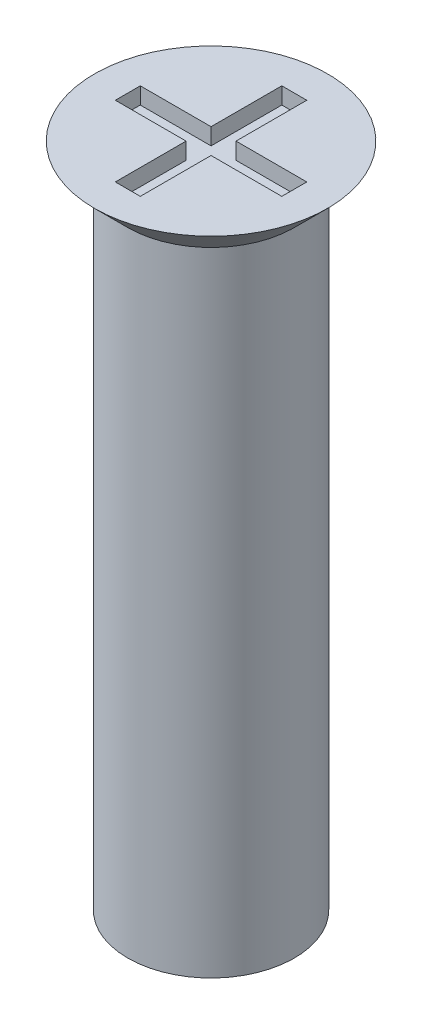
SolidWorks part; units mm, degrees
ref_plane "Front Plane" through (0, 0, 0) normal (0, 0, 1) x (1, 0, 0)
ref_plane "Top Plane" through (0, 0, 0) normal (0, 1, 0) x (1, 0, 0)
ref_plane "Right Plane" through (0, 0, 0) normal (1, 0, 0) x (0, 0, -1)
sketch "Sketch1" plane through (0, 0, 0) normal (0, 0, 1) x (1, 0, 0)
  line L0 (0, 2.4758) -> (0, -1.3504) construction
  line L1 (0, 0) -> (-0.5, 0)
  line L2 (-0.5, 0) -> (-0.5, 3.8)
  line L3 (-0.5, 3.8) -> (-0.7, 4)
  line L4 (-0.7, 4) -> (0, 4)
  line L5 (0, 4) -> (0, 0)
  dimension "D1" = 1
  dimension "D2" = 4
  dimension "D3" = 1.4
  dimension "D4" = 0.2
revolve "Revolve1" add sketch "Sketch1" angle 360 about L0
sketch "Sketch2" plane through (0, 4, 0) normal (0, 1, 0) x (1, 0, 0)
  line L0 (-0.075, 0) -> (0.5, 0) construction
  line L1 (0, 0.075) -> (0, -0.5) construction
  line L2 (-0.075, -0.075) -> (-0.075, -0.5)
  line L3 (-0.075, 0.5) -> (0.075, 0.5)
  line L4 (-0.075, 0.5) -> (-0.075, 0.075)
  line L5 (-0.075, -0.5) -> (0.075, -0.5)
  line L6 (0.075, 0.5) -> (0.075, 0.075)
  line L7 (0.5, 0.075) -> (0.075, 0.075)
  line L8 (0.5, 0.075) -> (0.5, -0.075)
  line L9 (0.5, -0.075) -> (0.075, -0.075)
  line L10 (-0.5, 0.075) -> (-0.5, -0.075)
  line L11 (0.075, -0.075) -> (0.075, -0.5)
  line L12 (-0.075, 0.075) -> (-0.5, 0.075)
  line L13 (-0.075, -0.075) -> (-0.5, -0.075)
  dimension "D1" = 1
  dimension "D2" = 1
  dimension "D3" = 0.15
  dimension "D4" = 0.15
extrude "Cut-Extrude1" cut sketch "Sketch2" against normal blind 0.1
